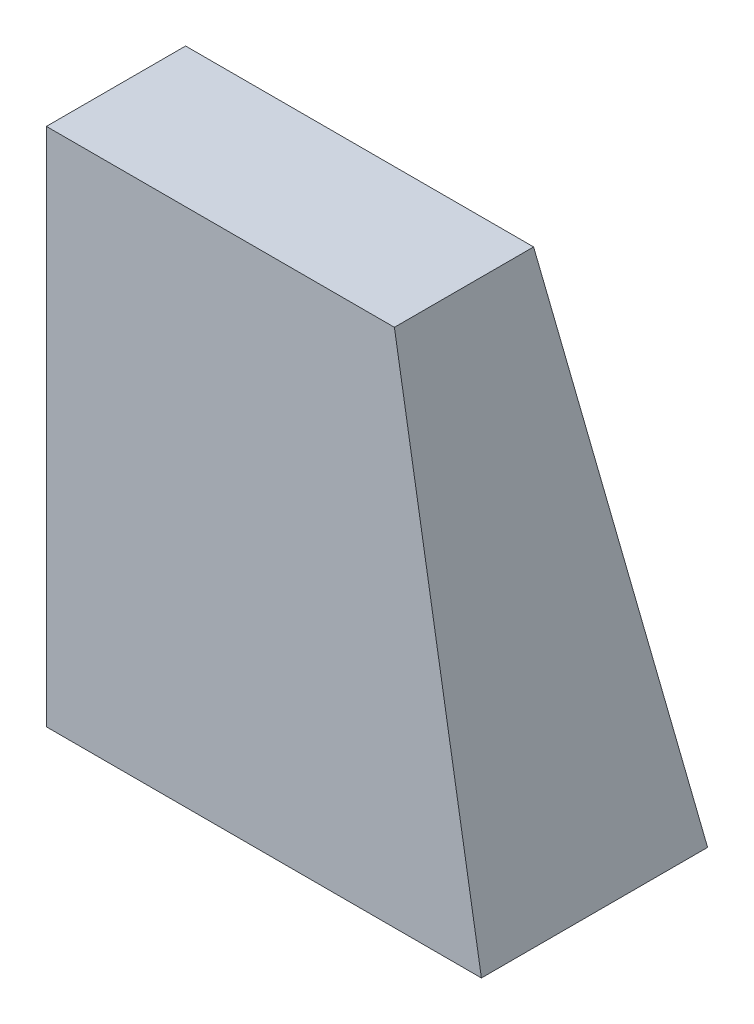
SolidWorks part; units mm, degrees
ref_plane "Front Plane" through (0, 0, 0) normal (0, 0, 1) x (1, 0, 0)
ref_plane "Top Plane" through (0, 0, 0) normal (0, 1, 0) x (1, 0, 0)
ref_plane "Right Plane" through (0, 0, 0) normal (1, 0, 0) x (0, 0, -1)
ref_plane "Plane1" through (0, 151.8199, 0) normal (0, 1, 0) x (-1, 0, 0)
sketch "Sketch1" plane through (0, 0, 0) normal (0, 1, 0) x (1, 0, 0)
  line L1 (0, 0) -> (127, 0)
  line L2 (0, 0) -> (0, 66.04)
  line L3 (0, 66.04) -> (127, 66.04)
  line L4 (127, 0) -> (127, 66.04)
  dimension "D1" = 127
  dimension "D2" = 66.04
sketch "Sketch2" plane through (0, 151.8199, 0) normal (0, 1, 0) x (-1, 0, 0)
  line L1 (0, 0) -> (-101.6, 0)
  line L2 (0, 0) -> (0, -40.64)
  line L3 (0, -40.64) -> (-101.6, -40.64)
  line L4 (-101.6, 0) -> (-101.6, -40.64)
  dimension "D1" = 101.6
  dimension "D2" = 40.64
loft "Loft1" add profiles "Sketch1", "Sketch2"
